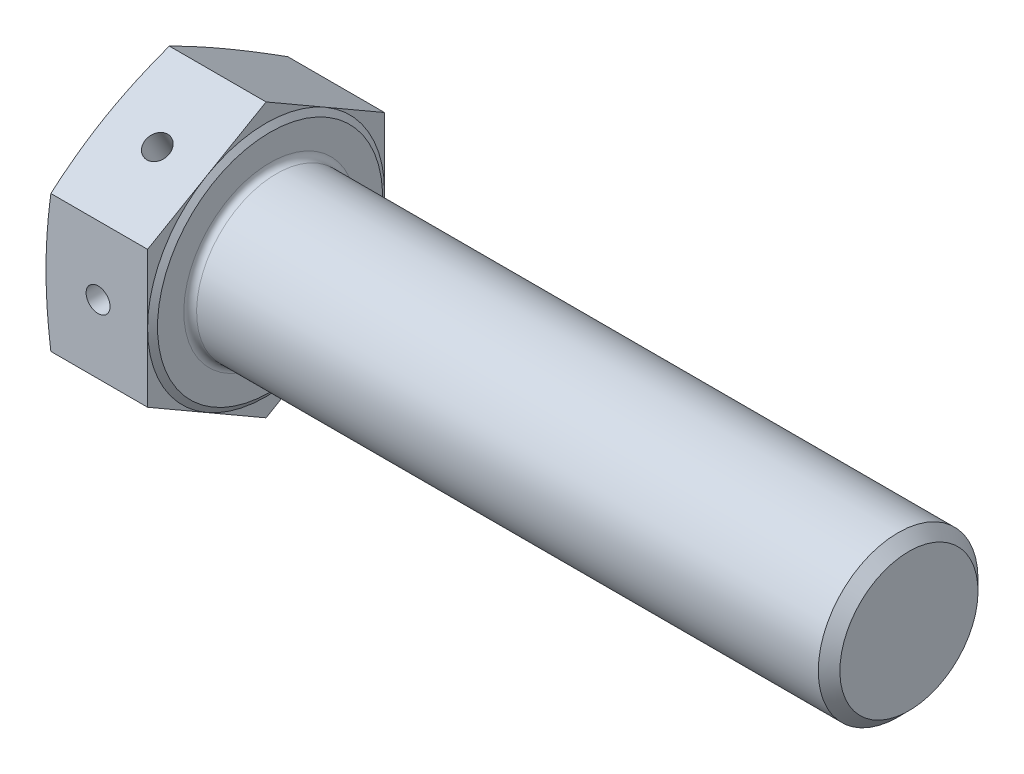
SolidWorks part; units mm, degrees
ref_plane "Front" through (0, 0, 0) normal (0, 0, 1) x (1, 0, 0)
ref_plane "Top" through (0, 0, 0) normal (0, 1, 0) x (1, 0, 0)
ref_plane "Right" through (0, 0, 0) normal (1, 0, 0) x (0, 0, -1)
sketch "Sketch-BaseHead" plane through (0, 0, 0) normal (1, 0, 0) x (0, 0, -1)
  line L1 (0, -17.13) -> (14.835, -8.565)
  line L2 (14.835, -8.565) -> (14.835, 8.565)
  line L3 (14.835, 8.565) -> (0, 17.13)
  line L4 (0, 17.13) -> (-14.835, 8.565)
  line L5 (-14.835, 8.565) -> (-14.835, -8.565)
  line L6 (-14.835, -8.565) -> (0, -17.13)
  circle A0 centre (0, 0) radius 14.835 construction
  dimension "s" = 29.67
extrude "BaseHead" add sketch "Sketch-BaseHead" along normal blind 12.72
sketch "Sketch4" plane through (-0.2646, -5.9169, 0) normal (0, 0, 1) x (0, 1, 0)
  line L0 (5.9169, 3.7369) -> (5.9169, -10.4477) construction
  line L2 (23.0469, -0.2646) -> (20.7519, -0.2646)
  line L4 (20.7519, -0.2646) -> (23.0469, -0.8725)
  line L6 (23.0469, -0.8725) -> (23.0469, -0.2646)
  dimension "D1" = 14.835
  dimension "D2" = 29.67
revolve "HeadChamfer" cut sketch "Sketch4" angle 360 about L0
sketch "Sketch2" plane through (0, 0, 0) normal (0, 1, 0) x (1, 0, 0)
  line L0 (12.72, 0) -> (13.22, 0)
  line L1 (13.22, 0) -> (13.22, 14.095)
  line L2 (13.22, 14.095) -> (12.72, 14.835)
  line L3 (12.72, 14.835) -> (12.72, 0)
  line L4 (12.72, 14.835) -> (12.72, 0) construction
  dimension "D1" = 14.835
  dimension "D2" = 14.095
  dimension "c" = 0.5
revolve "Revolve1" add sketch "Sketch2" angle 360 about axis through (-4.0016, 0, 0) along (1, 0, 0)
ref_plane "Plane2" through (47.22, 0, 0) normal (1, 0, 0) x (0, 0, -1)
sketch "Sketch3" plane through (13.22, 0, 0) normal (1, 0, 0) x (0, 0, -1)
  circle A0 centre (0, 0) radius 10
  dimension "d" = 20
extrude "BaseBody" add sketch "Sketch3" along normal blind 80
chamfer "Chamfer1" distance 1.353 angle 45 1 edges at (93.22, 10, 0)
fillet "HeadFillet" radius 0.8 1 edges at (13.22, -10, 0)
sketch "Sketch5" plane through (0, 0, 0) normal (0, 0, 1) x (1, 0, 0)
  line L1 (12.72, -12.8475) -> (12.72, -17.13) construction
  line L2 (-4.0016, 0) -> (10.1831, 0) construction
  circle A0 centre (6.52, 0) radius 1.5
  dimension "d1" = 3
  dimension "h" = 6.2
extrude "Hole" cut sketch "Sketch5" against normal through all and the other way through all
pattern_circular "CirPattern1" count 2 over 60 about axis through (93.22, 0, 0) along (-1, 0, 0) of "Hole"
equation "\"D1@Sketch4\" = \"s@Sketch-BaseHead\"/ 2 "
equation "\"D2@Sketch4\" = \"s@Sketch-BaseHead\""
equation "\"D1@Chamfer1\" =  ( \"d@Sketch3\" - \"D2@ThreadCosmetic1\" ) / 2 "
equation "\"b@ThreadCosmetic1\" = \"l@BaseBody\" - \"lg@Plane2\""
equation "\"D1@Sketch2\"=\"s@Sketch-BaseHead\"/2"
